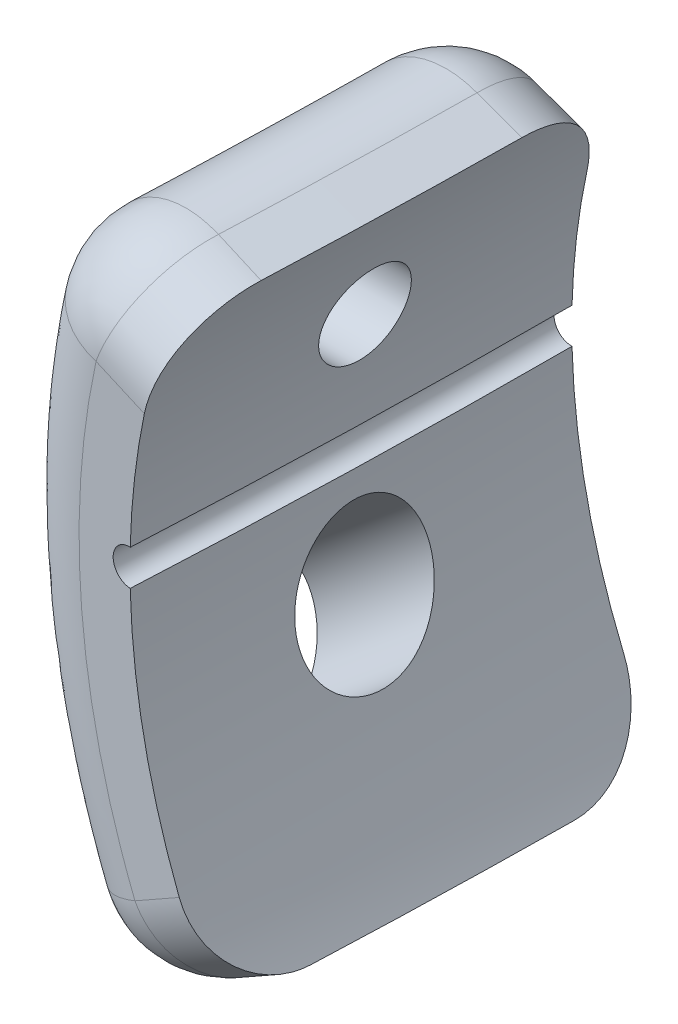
SolidWorks part; units mm, degrees
ref_plane "Спереди" through (0, 0, 0) normal (0, 0, 1) x (1, 0, 0)
ref_plane "Сверху" through (0, 0, 0) normal (0, 1, 0) x (1, 0, 0)
ref_plane "Справа" through (0, 0, 0) normal (1, 0, 0) x (0, 0, -1)
sketch "Эскиз1" plane through (0, 0, 0) normal (0, 0, 1) x (1, 0, 0)
  line L65 (0, 44.1102) -> (0, 0) construction
  line L75 (187.0705, -7.6045) -> (184.3122, -9.2267)
  line L92 (185, 0) -> (173.2912, 0) construction
  line L93 (185.8969, 5.109) -> (182.8882, 6.199)
  arc A20 (185.0053, 0.4) -> (185.0053, -0.4) centre (185, 0) ccw
  arc A39 (182.8882, 6.199) -> (184.3122, -9.2267) centre (200, 0) ccw
  arc A40 (185.8969, 5.109) -> (185.0053, 0.4) centre (200, 0) ccw
  arc A41 (185.0053, -0.4) -> (187.0705, -7.6045) centre (200, 0) ccw
  dimension "D1" = 15
  dimension "D3" = 18.2
  dimension "D4" = 0.8
  dimension "D2" = 200
revolve "Повернуть1" add sketch "Эскиз1" angle 3 about L65
ref_plane "Плоскость1" through (111.5289, 93.6159, 2.9205) normal (-0.7658, -0.6428, -0.0201) x (-0.0262, 0, 0.9997)
sketch "Эскиз3" plane through (111.5289, 93.6159, 2.9205) normal (-0.7658, -0.6428, -0.0201) x (-0.0262, 0, 0.9997)
  circle A0 centre (0, -121.1807) radius 1.5
  point P7 (-4.8496, -121.1807)
  dimension "D1" = 3
  dimension "D2" = 0
extrude "Вырез-Вытянуть1" cut sketch "Эскиз3" along normal blind 10
sketch "Эскиз4" plane through (0, 0, 0) normal (1, 0, 0) x (0, 0, -1)
  circle A0 centre (-4.8412, 2.7545) radius 1
  dimension "D1" = 2
extrude "Вырез-Вытянуть2" cut sketch "Эскиз4" along normal blind 200
chamfer "Фаска1" distance 1 angle 45 1 edges at (182.081, 3.6029, 5.3705)
fillet "Скругление1" radius 2 8 edges at (185.4369, -8.4156, 9.7183) (185.6913, -8.4156, 0) (184.3926, 5.654, 0) (184.1399, 5.654, 9.6504) (184.249, -9.2267, 4.8247) (181.8771, -1.673, 0) (182.8256, 6.199, 4.7875) (181.6278, -1.673, 9.5187)
